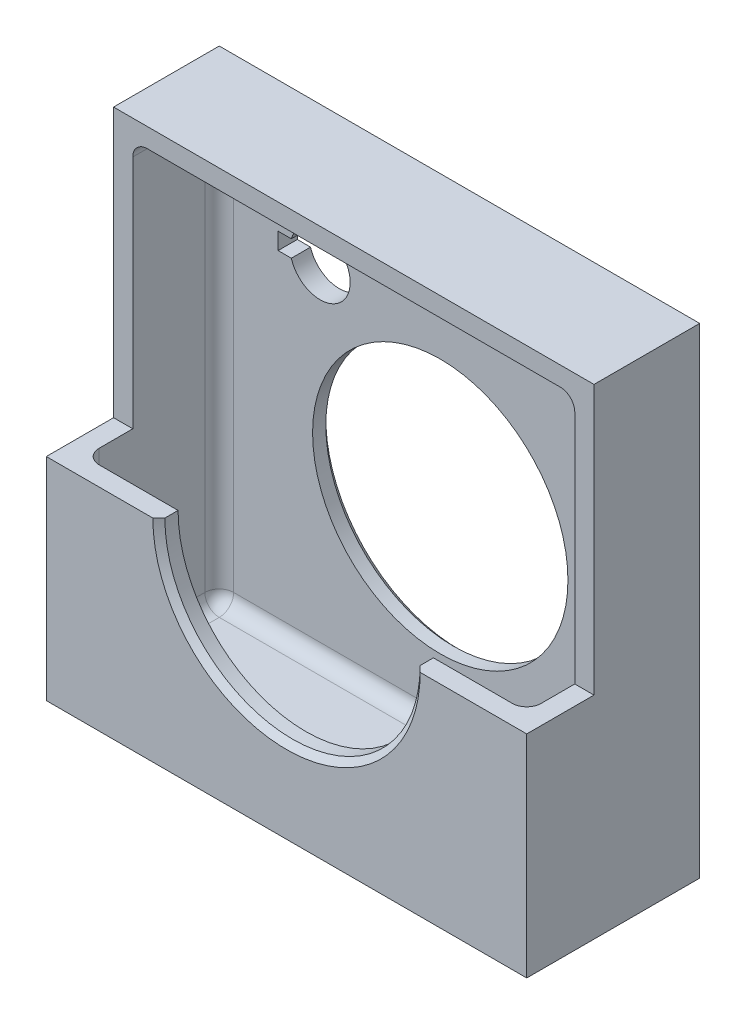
SolidWorks part; units mm, degrees
ref_plane "Front" through (0, 0, 0) normal (0, 0, 1) x (1, 0, 0)
ref_plane "Top" through (0, 0, 0) normal (0, 1, 0) x (1, 0, 0)
ref_plane "Right" through (0, 0, 0) normal (1, 0, 0) x (0, 0, -1)
sketch "Sketch1" plane through (0, 0, 0) normal (0, 0, 1) x (1, 0, 0)
  line L0 (-25.4, 0) -> (25.4, 0)
  line L1 (-25.4, 0) -> (-25.4, 50.8)
  line L2 (25.4, 50.8) -> (-25.4, 50.8)
  line L3 (25.4, 50.8) -> (25.4, 0)
  dimension "D1" = 50.8
  dimension "D2" = 50.8
extrude "main body" add sketch "Sketch1" along normal blind 18.288
sketch "Sketch2" plane through (25.4, 0, 0) normal (1, 0, 0) x (0, 0, -1)
  line L0 (-18.288, 50.8) -> (-11.176, 50.8)
  line L1 (-18.288, 50.8) -> (-18.288, 22.352)
  line L2 (-11.176, 22.352) -> (-18.288, 22.352)
  line L3 (-11.176, 22.352) -> (-11.176, 50.8)
  line L4 (-18.288, 0) -> (0, 0) construction
  line L5 (0, 50.8) -> (0, 0) construction
  dimension "D1" = 22.352
  dimension "D2" = 11.176
extrude "front cut" cut sketch "Sketch2" against normal through all
shell "Shell1" thickness 2.032
sketch "Sketch3" plane through (0, 0, 0) normal (0, 0, 1) x (1, 0, 0)
  line L2 (-25.4, 22.352) -> (25.4, 22.352) construction
  circle A0 centre (0, 22.352) radius 13.5001
  dimension "D1" = 27.0002
extrude "center hole" cut sketch "Sketch3" along normal through all
fillet "fill060.vert" radius 1.524 4 edges at (-23.368, 12.192, 16.256) (23.368, 12.192, 16.256) (-23.368, 25.4, 2.032) (23.368, 25.4, 2.032)
fillet "fill060.tb" radius 1.524 13 edges at (-23.368, 48.768, 7.366) (23.368, 48.768, 7.366) (0, 2.032, 16.256) (0, 2.032, 2.032) (-23.368, 2.032, 9.144) (23.368, 2.032, 9.144) (-22.9216, 2.032, 15.8096) (-22.9216, 2.032, 2.4784) (22.9216, 2.032, 2.4784) (22.9216, 2.032, 15.8096) (0, 48.768, 2.032) (-22.9216, 48.768, 2.4784) (22.9216, 48.768, 2.4784)
chamfer "cham025" distance 0.635 angle 45 2 edges at (13.5001, 22.352, 0) (0, 8.8519, 18.288)
sketch "Sketch6" plane through (10.2558, 39.4618, 0) normal (0, 0, -1) x (-1, 0, 0)
  line L0 (19.7808, -1.3618) -> (27.4008, -1.3618) construction
  line L1 (22.9558, 1.8132) -> (22.9558, -4.5368) construction
  line L2 (26.0038, -0.4728) -> (27.4008, -0.4728)
  line L4 (27.4008, -2.2508) -> (26.0038, -2.2508)
  line L5 (27.4008, -2.2508) -> (27.4008, -0.4728)
  line L7 (-15.1442, 11.3382) -> (35.6558, 11.3382) construction
  line L8 (35.6558, -39.4618) -> (35.6558, 11.3382) construction
  arc A0 (26.0038, -0.4728) -> (26.0038, -2.2508) centre (22.9558, -1.3618) ccw
  point P10 (27.4008, -1.3618)
  dimension "D1" = 12.7
  dimension "Diameter" = 6.35
  dimension "D2" = 12.7
  dimension "Tab width" = 1.778
  dimension "Tab depth" = 1.27
extrude "Keyed Hole 1" cut sketch "Sketch6" against normal through all
